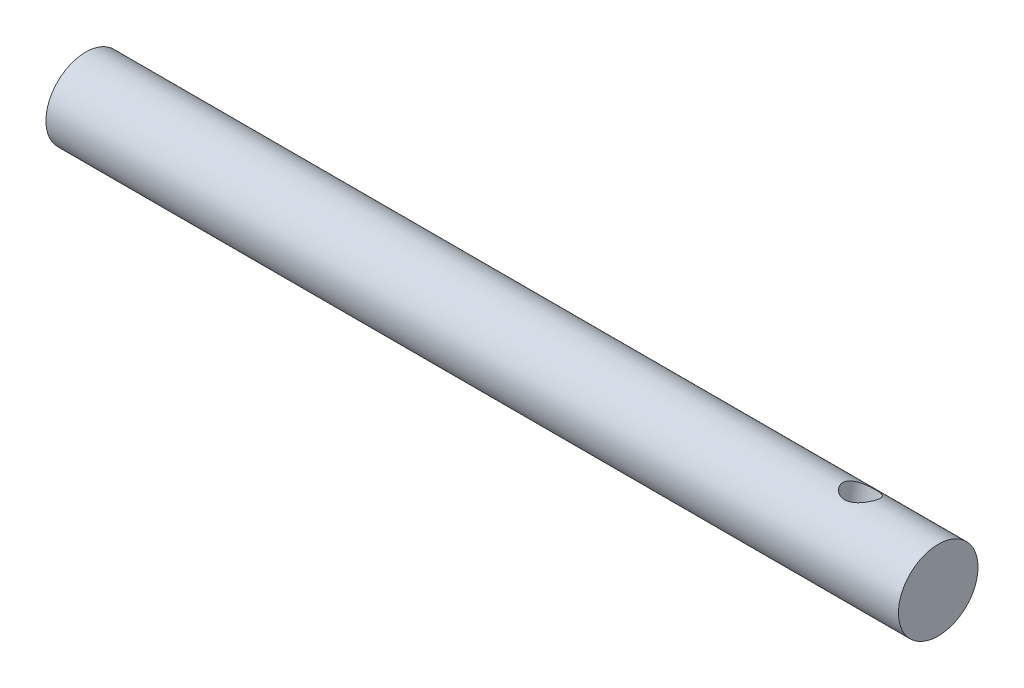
SolidWorks part; units mm, degrees
ref_plane "Front Plane" through (0, 0, 0) normal (0, 0, 1) x (1, 0, 0)
ref_plane "Top Plane" through (0, 0, 0) normal (0, 1, 0) x (1, 0, 0)
ref_plane "Right Plane" through (0, 0, 0) normal (1, 0, 0) x (0, 0, -1)
sketch "Sketch1" plane through (0, 0, 0) normal (1, 0, 0) x (0, 0, -1)
  circle A1 centre (-31.6861, 21.5873) radius 10.668
  dimension "D2" = 21.336
extrude "Boss-Extrude3" add sketch "Sketch1" along normal blind 228.6
hole_wizard "#97 (0.0059) Diameter Hole1" positions "Sketch5" profile "Sketch4" hole size "#97" standard "Ansi Inch"
sketch "Sketch5" plane through (0, 0, 0) normal (-1, 0, 0) x (0, 0, 1)
  circle A0 centre (31.6861, 21.5873) radius 10.668 construction
  point P0 (31.6861, 21.5873)
  dimension "D1" = 0
  dimension "D2" = 0
sketch "Sketch4" plane through (0, 21.5873, 31.6861) normal (0, 1, 0) x (0, 0, 1)
  line L0 (0, 0) -> (0, 226.06)
  line L1 (0, 226.06) -> (6.35, 226.06)
  line L2 (6.35, 226.06) -> (6.35, 0)
  line L5 (6.35, 0) -> (0, 0)
  line L10 (0, 226.06) -> (-6.35, 226.06) construction
  line L11 (0, -6.35) -> (0, 107.95) construction
  dimension "Hole Dia." = 12.7
  dimension "Hole Depth" = 226.06
  dimension "Drill Angle" = 180
hole_wizard "#97 (0.0059) Diameter Hole2" positions "3DSketch3" profile "Sketch7" hole size "#97" standard "Ansi Inch"
sketch3d "3DSketch3"
  circle A1 centre (228.6, 21.5873, 31.6861) radius 10.668 construction
  point P0 (205.5489, 32.0074, 29.3996)
  point P7 (239.268, 21.5873, 31.6861)
  dimension "D1" = 25.4
sketch "Sketch7" plane through (205.5489, 32.0074, 29.3996) normal (1, 0, 0) x (0, 0.2143, 0.9768)
  line L0 (0, 0) -> (0, 6.35)
  line L1 (0, 6.35) -> (4.2333, 6.35)
  line L2 (4.2333, 6.35) -> (4.2333, 0)
  line L5 (4.2333, 0) -> (0, 0)
  line L10 (0, 6.35) -> (-4.2333, 6.35) construction
  line L11 (0, -6.35) -> (0, 107.95) construction
  dimension "Hole Dia." = 8.4667
  dimension "Hole Depth" = 6.35
  dimension "Drill Angle" = 180
hole_wizard "#97 (0.0059) Diameter Hole3" positions "3DSketch4" profile "Sketch8" hole size "#97" standard "Ansi Inch"
sketch3d "3DSketch4"
  circle A0 centre (0, 21.5873, 31.6861) radius 6.35 construction
  point P0 (16.3924, 10.9212, 31.886)
  point P1 (46.8697, 10.9212, 31.4862)
  point P3 (78.6097, 10.9362, 32.2859)
  point P5 (115.4201, 10.9362, 31.0864)
  point P7 (153.5116, 11.0115, 30.2867)
  point P11 (-6.35, 21.5873, 31.6861)
  dimension "D1" = 38.1
  dimension "D2" = 36.83
  dimension "D3" = 31.75
  dimension "D4" = 30.48
  dimension "D5" = 19.558
sketch "Sketch8" plane through (16.3924, 10.9212, 31.886) normal (1, 0, 0) x (0, -0.0187, -0.9998)
  line L0 (0, 0) -> (0, 6.35)
  line L1 (0, 6.35) -> (4.2333, 6.35)
  line L2 (4.2333, 6.35) -> (4.2333, 0)
  line L5 (4.2333, 0) -> (0, 0)
  line L10 (0, 6.35) -> (-4.2333, 6.35) construction
  line L11 (0, -6.35) -> (0, 107.95) construction
  dimension "Hole Dia." = 8.4667
  dimension "Hole Depth" = 6.35
  dimension "Drill Angle" = 180
